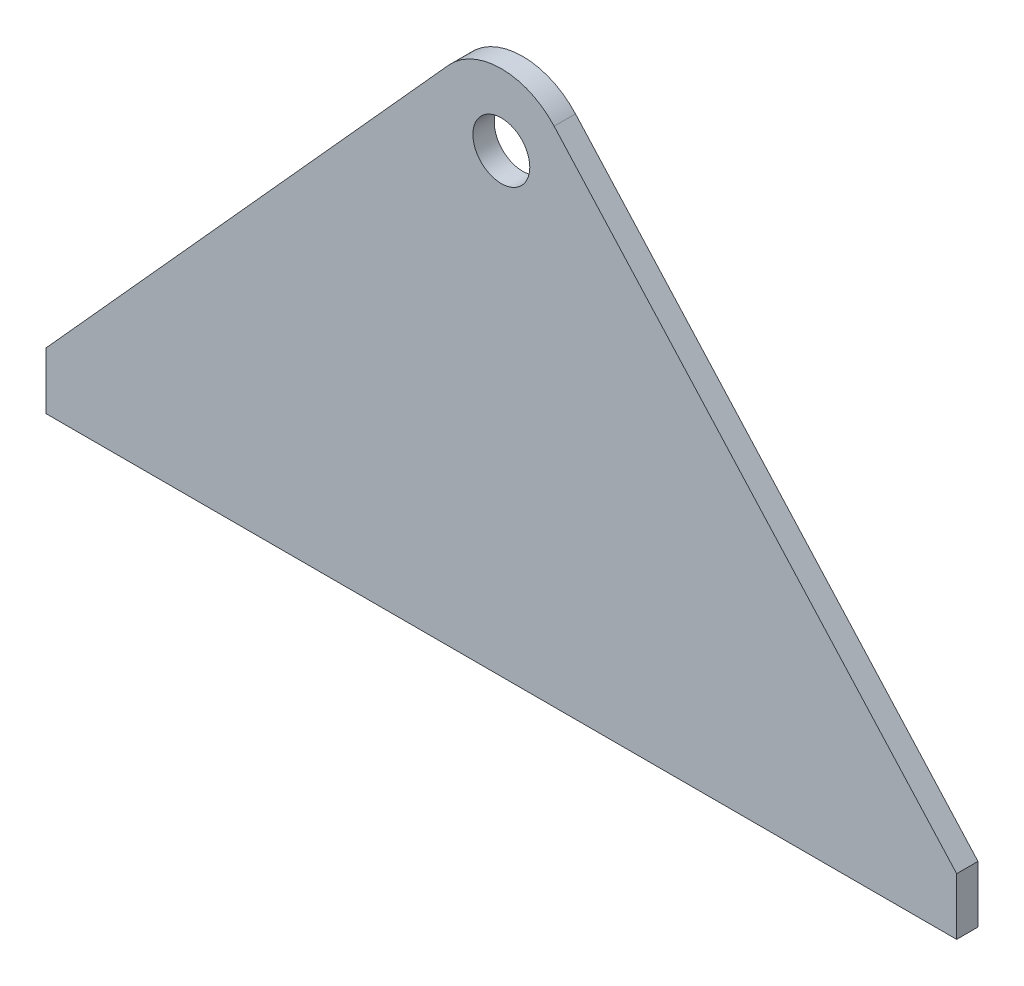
SolidWorks part; units mm, degrees
ref_plane "Front Plane" through (0, 0, 0) normal (0, 0, 1) x (1, 0, 0)
ref_plane "Top Plane" through (0, 0, 0) normal (0, 1, 0) x (1, 0, 0)
ref_plane "Right Plane" through (0, 0, 0) normal (1, 0, 0) x (0, 0, -1)
sketch "Sketch1" plane through (0, 0, 0) normal (0, 0, 1) x (1, 0, 0)
  line L0 (-203.2, -203.2) -> (203.2, -203.2)
  line L1 (-203.2, -203.2) -> (-203.2, -177.8)
  line L2 (203.2, -203.2) -> (203.2, -177.8)
  line L3 (-203.2, -177.8) -> (-23.5722, 21.27)
  line L4 (203.2, -177.8) -> (23.5722, 21.27)
  circle A0 centre (0, 0) radius 12.7
  arc A1 (23.5722, 21.27) -> (-23.5722, 21.27) centre (0, 0) ccw
  dimension "D1" = 406.4
  dimension "D3" = 19.05
  dimension "D5" = 25.4
  dimension "D2" = 203.2
  dimension "D4" = 203.2
  dimension "D6" = 25.4
  dimension "D7" = 25.4
extrude "Extrude1" add sketch "Sketch1" against normal blind 9.525
